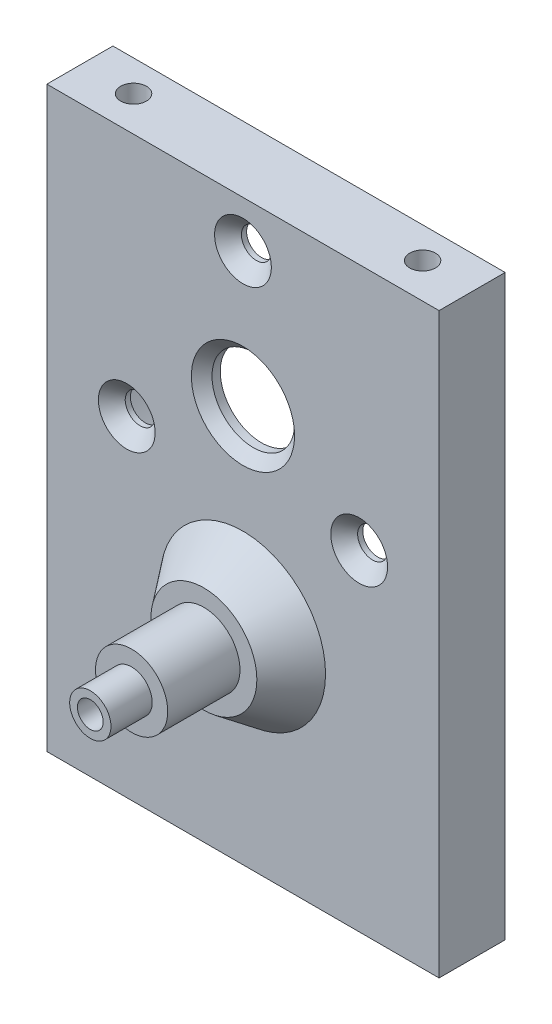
SolidWorks part; units mm, degrees
ref_plane "Plano frontal" through (0, 0, 0) normal (0, 0, 1) x (1, 0, 0)
ref_plane "Plano superior" through (0, 0, 0) normal (0, 1, 0) x (1, 0, 0)
ref_plane "Plano direito" through (0, 0, 0) normal (1, 0, 0) x (0, 0, -1)
sketch "Esboço1" plane through (0, 0, 0) normal (0, 0, 1) x (1, 0, 0)
  line L0 (-19, 0) -> (19, 0)
  line L1 (19, 0) -> (19, 56)
  line L2 (19, 56) -> (-19, 56)
  line L4 (-19, 56) -> (-19, 0)
  circle A1 centre (0, 20) radius 4
  point P9 (-19, 0)
  dimension "D7" = 8
  dimension "D2" = 38
  dimension "D4" = 56
  dimension "D8" = 20
  dimension "D11" = 38
extrude "Ressalto-extrusão1" add sketch "Esboço1" along normal blind 6.4
sketch "Esboço6" plane through (0, 0, 0) normal (0, 0, -1) x (-1, 0, 0)
  line L1 (0, 38.5) -> (-19, 38.5) construction
  line L3 (-19, 0) -> (-19, 56) construction
  line L5 (0, 38.5) -> (0, 0) construction
  line L6 (19, 0) -> (-19, 0) construction
  circle A0 centre (0, 38.5) radius 16.54
  circle A1 centre (0, 20) radius 4 construction
  circle A2 centre (0, 20) radius 4 construction
  dimension "D1" = 33.08
  dimension "D2" = 18.5
  dimension "D3" = 19
extrude "Corte-extrusão5" cut sketch "Esboço6" against normal blind 4.6
sketch "Esboço7" plane through (0, 0, 4.6) normal (0, 0, -1) x (-1, 0, 0)
  line L0 (0, 51.5) -> (0, 38.5) construction
  line L1 (0, 38.5) -> (-11.2583, 32) construction
  circle A0 centre (0, 38.5) radius 4
  circle A1 centre (11.2583, 32) radius 1.25
  circle A2 centre (-11.2583, 32) radius 1.25
  circle A3 centre (0, 38.5) radius 16.54 construction
  circle A4 centre (0, 51.5) radius 1.25
  dimension "D1" = 8
  dimension "D2" = 2.5
  dimension "D6" = 13
  dimension "D3" = 13
  dimension "D5" = 120
  dimension "D4" = 3
extrude "Corte-extrusão6" cut sketch "Esboço7" against normal through all
hole_wizard "Escareado para parafuso de máquina com cabeça chata de M2.51" positions "Esboço9" profile "Esboço10" countersink size "M2.5" standard "Métrico Ansi"
sketch "Esboço9" plane through (0, 0, 6.4) normal (0, 0, 1) x (1, 0, 0)
  point P0 (0, 51.5)
  point P1 (11.2583, 32)
  point P4 (-11.2583, 32)
sketch "Esboço10" plane through (0, 51.5, 6.4) normal (1, 0, 0) x (0, -1, 0)
  line L0 (0, 0) -> (0, 2.6702)
  line L1 (0, 2.6702) -> (1.45, 1.799)
  line L2 (1.45, 1.799) -> (1.45, 1.3)
  line L3 (1.45, 1.3) -> (2.75, 0)
  line L5 (2.75, 0) -> (0, 0)
  line L6 (-1.45, 1.3) -> (-2.75, 0) construction
  line L10 (0, 2.6702) -> (-1.45, 1.799) construction
  line L11 (0, -6.35) -> (0, 107.95) construction
  dimension "Hole Dia." = 2.9
  dimension "Hole Depth" = 1.799
  dimension "Near C'Sink Dia." = 5.5
  dimension "Near C'Sink Angle" = 90
  dimension "Drill Angle" = 118
sketch "Esboço15" plane through (0, 0, 0) normal (0, 0, -1) x (-1, 0, 0)
  arc A0 (-3.2806, 22.2886) -> (3.2806, 22.2886) centre (0, 20) ccw construction
  arc A1 (-3.2806, 22.2886) -> (3.2806, 22.2886) centre (0, 20) ccw
  arc A2 (-3.2806, 22.2886) -> (3.2806, 22.2886) centre (0, 38.5) ccw
  arc A3 (3.2806, 22.2886) -> (-3.2806, 22.2886) centre (0, 38.5) ccw construction
extrude "Ressalto-extrusão2" add sketch "Esboço15" against normal up to surface (4.6 mm away)
sketch "Esboço16" plane through (0, 0, 4.6) normal (0, 0, 1) x (1, 0, 0)
  arc A0 (-3.2806, 22.2886) -> (3.2806, 22.2886) centre (0, 20) ccw construction
  arc A1 (3.2806, 22.2886) -> (-3.2806, 22.2886) centre (0, 20) ccw construction
  arc A2 (-3.2806, 22.2886) -> (3.2806, 22.2886) centre (0, 20) ccw
  arc A3 (3.2806, 22.2886) -> (-3.2806, 22.2886) centre (0, 20) ccw
extrude "Ressalto-extrusão3" add sketch "Esboço16" along normal blind 5.59
sketch "Esboço17" plane through (0, 0, 10.19) normal (0, 0, 1) x (1, 0, 0)
  circle A0 centre (0, 20) radius 3.5
  dimension "D1" = 7
extrude "Ressalto-extrusão4" add sketch "Esboço17" along normal blind 7
sketch "Esboço18" plane through (0, 0, 17.19) normal (0, 0, 1) x (1, 0, 0)
  circle A0 centre (0, 20) radius 2
  dimension "D1" = 4
extrude "Ressalto-extrusão5" add sketch "Esboço18" along normal blind 4
chamfer "Chanfro1" distance 4 distance2 5.29 1 edges at (4, 20, 6.4)
hole_wizard "Furo roscado de M3x0.51" positions "Esboço22" profile "Esboço21" tap size "M3x0.5" standard "Ansi Metric"
sketch "Esboço22" plane through (0, 0, 21.19) normal (0, 0, 1) x (1, 0, 0)
  point P0 (0, 20)
sketch "Esboço21" plane through (0, 20, 21.19) normal (1, 0, 0) x (0, -1, 0)
  line L0 (0, 0) -> (0, 10.7511)
  line L1 (0, 10.7511) -> (1.25, 10)
  line L2 (1.25, 10) -> (1.25, 0)
  line L5 (1.25, 0) -> (0, 0)
  line L10 (0, 10.7511) -> (-1.25, 10) construction
  line L11 (0, -6.35) -> (0, 107.95) construction
  dimension "Tap Drill Dia." = 2.5
  dimension "Tap Drill Depth" = 10
  dimension "Drill Angle" = 118
sketch "Esboço29" plane through (0, 0, 0) normal (0, -1, 0) x (1, 0, 0)
  line L0 (-19, 3.2) -> (19, 3.2) construction
  line L1 (-19, 6.4) -> (-19, 0) construction
  line L2 (19, 6.4) -> (19, 0) construction
  point P6 (-12, 3.2)
  point P7 (0, 3.2)
  point P8 (12, 3.2)
  dimension "D1" = 12
  dimension "D2" = 12
sketch "Esboço30" plane through (0, 56, 0) normal (0, 1, 0) x (1, 0, 0)
  line L0 (19, -3.2) -> (-19, -3.2) construction
  line L1 (19, -6.4) -> (19, 0) construction
  line L2 (-19, -6.4) -> (-19, 0) construction
  point P6 (14, -3.2)
  point P7 (-14, -3.2)
  dimension "D1" = 5
  dimension "D2" = 5
chamfer "Chanfro2" distance 1 angle 45 1 edges at (-4, 38.5, 6.4)
sketch "Esboço35" plane through (0, 0, 6.4) normal (0, 0, 1) x (1, 0, 0)
  line L0 (-12.3294, 0) -> (12.3294, 0)
  line L1 (-19, 0) -> (19, 0) construction
  arc A0 (12.3294, 0) -> (16.4499, 36.7755) centre (0, 20) ccw
  arc A1 (-16.4499, 36.7755) -> (16.4499, 36.7755) centre (0, 38.5) ccw
  arc A2 (-16.4499, 36.7755) -> (-12.3294, 0) centre (0, 20) ccw
  dimension "D1" = 46.99
  dimension "D2" = 33.08
extrude "Ressalto-extrusão6" [suppressed] add sketch "Esboço35" against normal blind 6
chamfer "Chanfro3" [suppressed] distance 10 distance2 10
fillet "Filete2" [suppressed] radius 80
chamfer "Chanfro4" [suppressed] distance 10 distance2 10
sketch "Sketch1" plane through (0, 56, 0) normal (0, 1, 0) x (1, 0, 0)
  line L0 (19, 0) -> (-19, 0) construction
  line L1 (-19, -6.4) -> (-19, 0) construction
  line L2 (0, 0) -> (0, -6.4) construction
  line L3 (19, -6.4) -> (-19, -6.4) construction
  circle A0 centre (-14, -3) radius 1.25
  circle A1 centre (14, -3) radius 1.25
  point P0 (-14, -3)
  point P2 (14, -3)
  dimension "D3" = 2.5
  dimension "D1" = 3
  dimension "D2" = 5
extrude "Cut-Extrude1" cut sketch "Sketch1" against normal blind 6
sketch "Sketch2" plane through (0, 0, 0) normal (0, -1, 0) x (-1, 0, 0)
  line L0 (19, 0) -> (-19, 0) construction
  line L1 (0, 0) -> (0, -6.4) construction
  line L2 (19, -6.4) -> (-19, -6.4) construction
  line L3 (-19, -6.4) -> (-19, 0) construction
  circle A0 centre (-12, -3) radius 1.25
  circle A1 centre (0, -3) radius 1.25
  circle A2 centre (12, -3) radius 1.25
  dimension "D2" = 2.5
  dimension "D3" = 7
  dimension "D1" = 3
extrude "Cut-Extrude2" cut sketch "Sketch2" against normal blind 10
